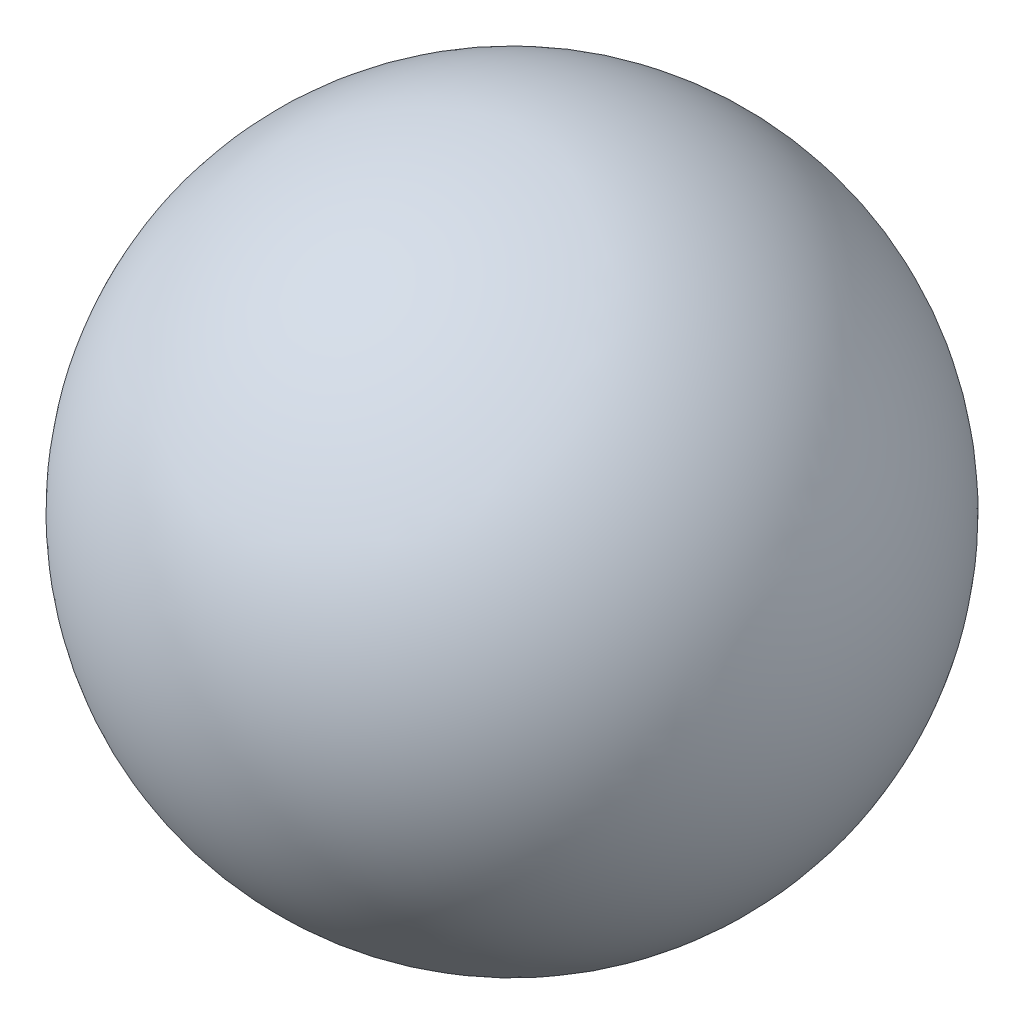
SolidWorks part; units mm, degrees
ref_plane "Plan de face" through (0, 0, 0) normal (0, 0, 1) x (1, 0, 0)
ref_plane "Plan de dessus" through (0, 0, 0) normal (0, 1, 0) x (1, 0, 0)
ref_plane "Plan de droite" through (0, 0, 0) normal (1, 0, 0) x (0, 0, -1)
sketch "Esquisse1" plane through (0, 0, 0) normal (0, 1, 0) x (1, 0, 0)
  line L0 (-6.15, 0) -> (6.15, 0) construction
  line L1 (-6.15, 0) -> (6.15, 0)
  arc A0 (-6.15, 0) -> (6.15, 0) centre (0, 0) ccw
  dimension "D1" = 12.3
revolve "Révolution4" add sketch "Esquisse1" angle 360 about L0
